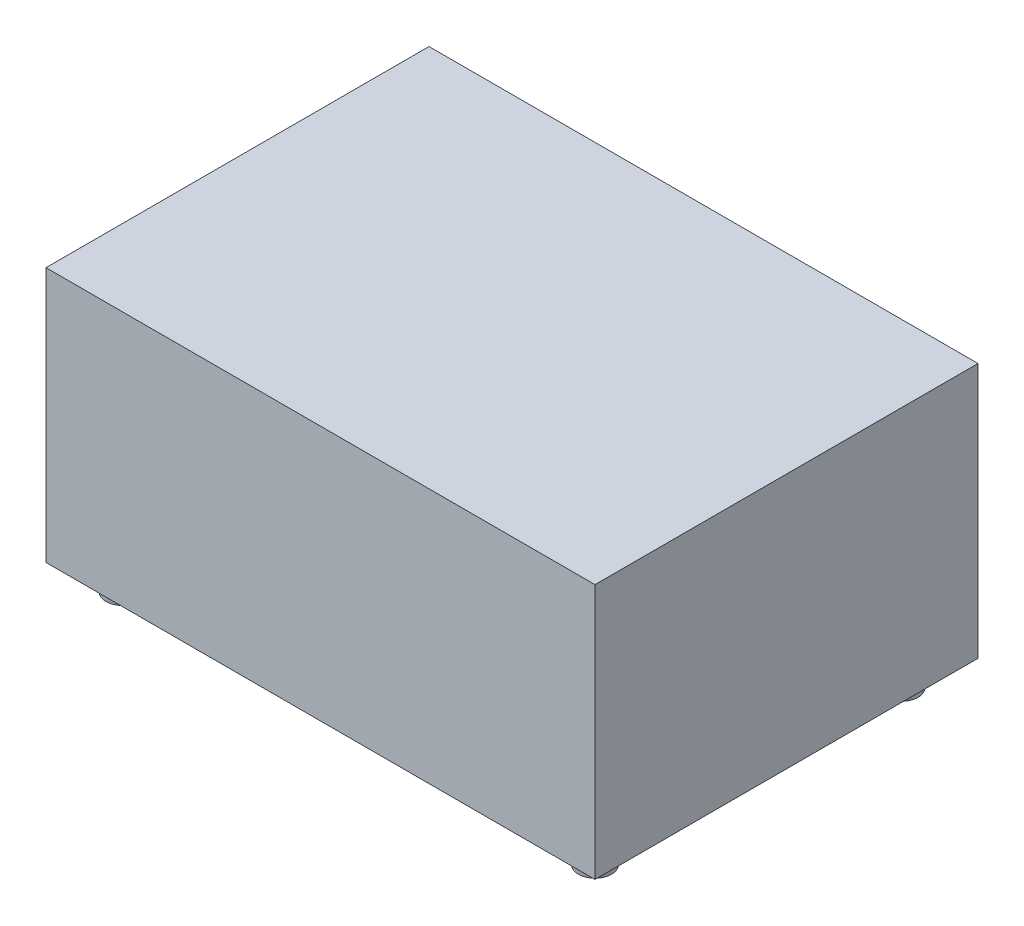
SolidWorks part; units mm, degrees
ref_plane "前基準面" through (0, 0, 0) normal (0, 0, 1) x (1, 0, 0)
ref_plane "上基準面" through (0, 0, 0) normal (0, 1, 0) x (1, 0, 0)
ref_plane "右基準面" through (0, 0, 0) normal (1, 0, 0) x (0, 0, -1)
sketch "草圖1" plane through (0, 0, 0) normal (0, 0, 1) x (1, 0, 0)
  line L1 (0, 0) -> (215, 0)
  line L2 (0, 0) -> (0, -100)
  line L3 (0, -100) -> (215, -100)
  line L4 (215, 0) -> (215, -100)
  dimension "D1" = 215
  dimension "D2" = 100
extrude "填料-伸長1" add sketch "草圖1" along normal blind 150
sketch "草圖2" plane through (0, -100, 0) normal (0, -1, 0) x (1, 0, 0)
  line L0 (0, 0) -> (215, 0) construction
  line L1 (0, 150) -> (0, 0) construction
  line L2 (0, 150) -> (215, 150) construction
  line L3 (215, 150) -> (215, 0) construction
  circle A0 centre (15, 15) radius 7.5
  circle A1 centre (15, 135) radius 7.5
  circle A2 centre (200, 15) radius 7.5
  circle A3 centre (200, 135) radius 7.5
  dimension "D1" = 15
  dimension "D2" = 15
  dimension "D7" = 15
  dimension "D8" = 15
  dimension "D3" = 15
  dimension "D4" = 15
  dimension "D5" = 15
  dimension "D6" = 15
  dimension "D9" = 15
  dimension "D10" = 15
extrude "填料-伸長2" add sketch "草圖2" along normal blind 10
chamfer "導角1" distance 10 distance2 1 4 edges at (15, -110, 7.5) (200, -110, 127.5) (15, -110, 127.5) (200, -110, 7.5)
